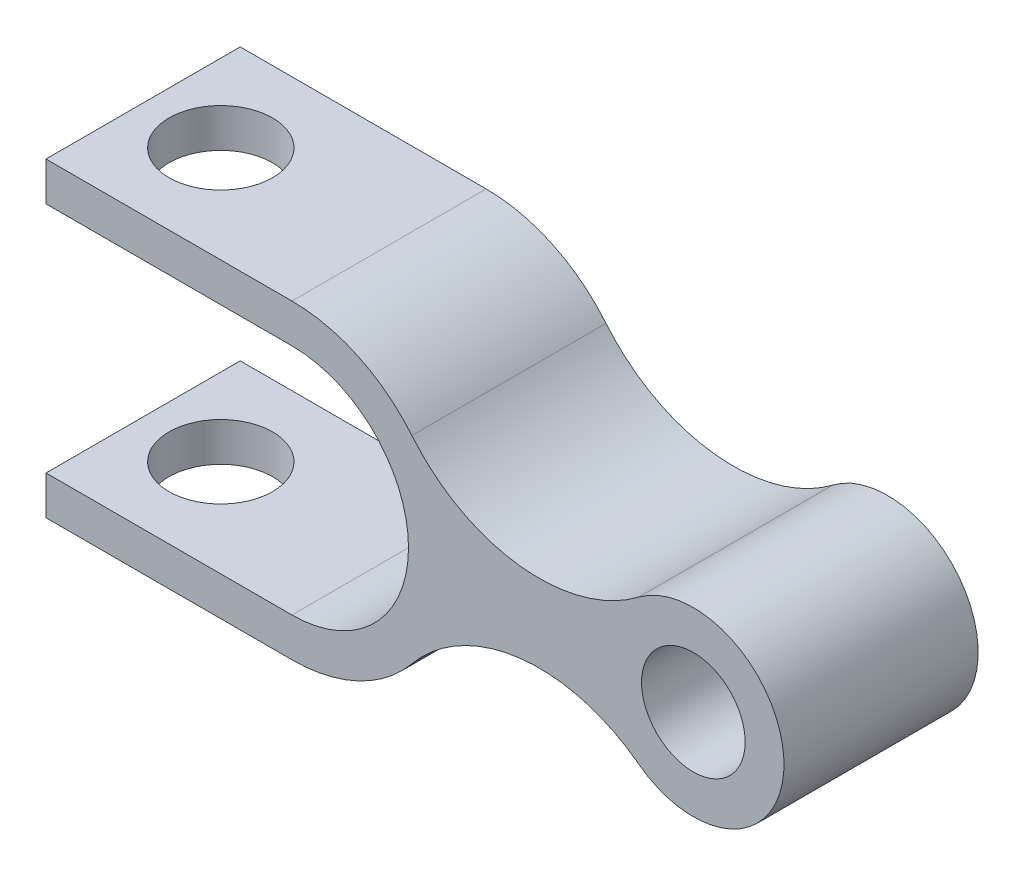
SolidWorks part; units mm, degrees
ref_plane "Face" through (0, 0, 0) normal (0, 0, 1) x (1, 0, 0)
ref_plane "Dessus" through (0, 0, 0) normal (0, 1, 0) x (1, 0, 0)
ref_plane "Droite" through (0, 0, 0) normal (1, 0, 0) x (0, 0, -1)
sketch "Esquisse1" plane through (0, 0, 0) normal (0, 0, 1) x (1, 0, 0)
  line L0 (77, 12) -> (96, 12)
  line L1 (77, 12) -> (77, 9)
  line L2 (77, 9) -> (96, 9)
  line L5 (83, -35) -> (83, 205) construction
  line L6 (77, -12) -> (96, -12)
  line L7 (77, -12) -> (77, -9)
  line L9 (77, -9) -> (96, -9)
  circle A0 centre (127, 0) radius 4
  arc A1 (122.7755, -5.5815) -> (122.7755, 5.5815) centre (127, 0) ccw
  arc A2 (96, -9) -> (96, 9) centre (96, 0) ccw
  arc A3 (105.2582, 7.6346) -> (96, 12) centre (96, 0) ccw
  arc A4 (105.2582, 7.6346) -> (122.7755, 5.5815) centre (115.0871, 15.7398) ccw
  arc A5 (105.2582, -7.6346) -> (122.7755, -5.5815) centre (115.0871, -15.7398) cw
  arc A6 (105.2582, -7.6346) -> (96, -12) centre (96, 0) cw
  dimension "D1" = 8
  dimension "D2" = 14
  dimension "D7" = 19
  dimension "D6" = 9
  dimension "D8" = 12
  dimension "D4" = 3
  dimension "D5" = 6
extrude "Base-Extrusion" add sketch "Esquisse1" along normal mid plane 15
sketch "Esquisse2" plane through (0, -12, 0) normal (0, -1, 0) x (1, 0, 0)
  line L0 (34.8538, 0) -> (-34.8538, 0) construction
  circle A0 centre (83, 0) radius 4
  circle A1 centre (83, 0) radius 3 construction
  dimension "D1" = 8
extrude "Enlèv. mat.-Extru.1" cut sketch "Esquisse2" against normal through all
